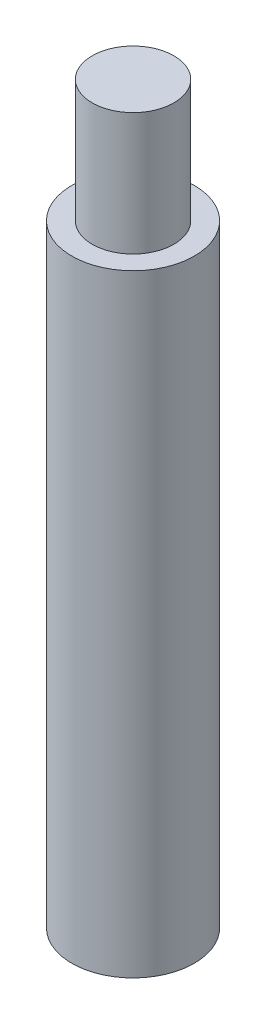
SolidWorks part; units mm, degrees
ref_plane "Face" through (0, 0, 0) normal (0, 0, 1) x (1, 0, 0)
ref_plane "Dessus" through (0, 0, 0) normal (0, 1, 0) x (1, 0, 0)
ref_plane "Droite" through (0, 0, 0) normal (1, 0, 0) x (0, 0, -1)
sketch "Esquisse1" plane through (0, 0, 0) normal (0, 0, 1) x (1, 0, 0)
  line L0 (0, -2.2209) -> (0, 12.5351) construction
  line L1 (0, 0) -> (1.5, 0)
  line L2 (1.5, 0) -> (1.5, 15)
  line L3 (1.5, 15) -> (1, 15)
  line L4 (1, 15) -> (1, 18)
  line L5 (1, 18) -> (0, 18)
  line L6 (0, 18) -> (0, 0)
  dimension "D1" = 1.5
  dimension "D2" = 1
  dimension "D3" = 18
  dimension "D4" = 15
revolve "Révolution1" add sketch "Esquisse1" angle 360 about L0
